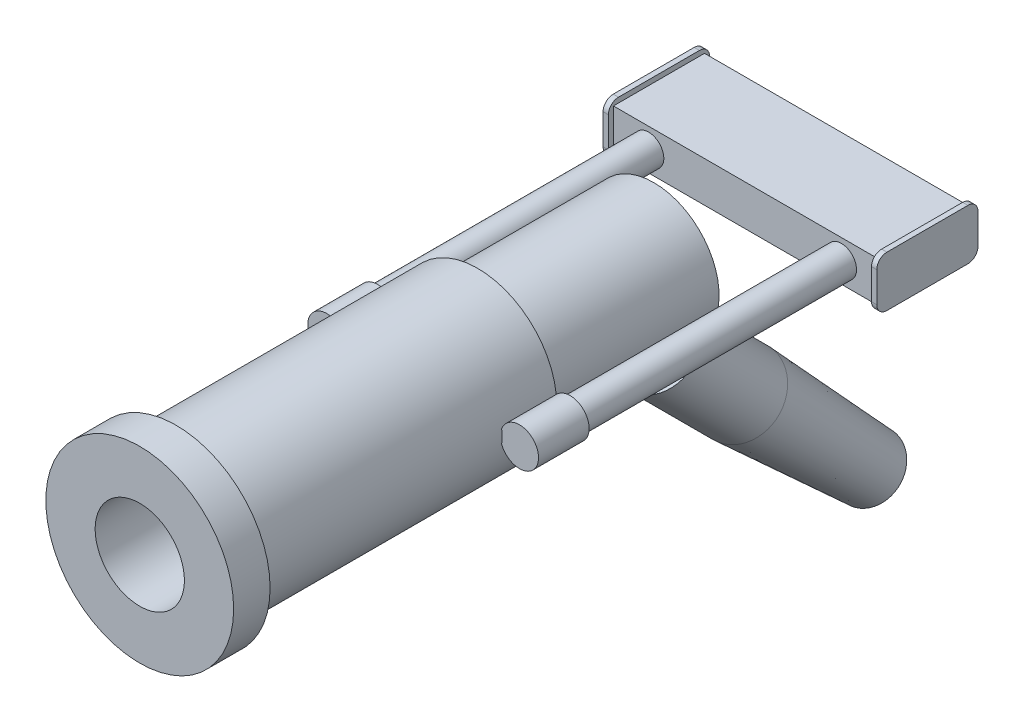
SolidWorks part; units mm, degrees
ref_plane "Front" through (0, 0, 0) normal (0, 0, 1) x (1, 0, 0)
ref_plane "Top" through (0, 0, 0) normal (0, 1, 0) x (1, 0, 0)
ref_plane "Right" through (0, 0, 0) normal (1, 0, 0) x (0, 0, -1)
mirrored part "HV FLYING CONNECTOR AND CABLE REV3_Mirrored"
other "<HV FLYING CONNECTOR AND CABLE REV3>-<Cut-Extrude1>"
other "<HV FLYING CONNECTOR AND CABLE REV3>-<Extrude9>"
other "<HV FLYING CONNECTOR AND CABLE REV3>-<Extrude6>"
other "<HV FLYING CONNECTOR AND CABLE REV3>-<Extrude7>"
other "<HV FLYING CONNECTOR AND CABLE REV3>-<Extrude8>"
other "<HV FLYING CONNECTOR AND CABLE REV3>-<Mirror1[1]>"
other "<HV FLYING CONNECTOR AND CABLE REV3>-<Mirror1[2]>"
other "<HV FLYING CONNECTOR AND CABLE REV3>-<Mirror1[3]>"
other "<HV FLYING CONNECTOR AND CABLE REV3>-<Cut-Extrude2>"
other "<HV FLYING CONNECTOR AND CABLE REV3>-<Revolve1>"
